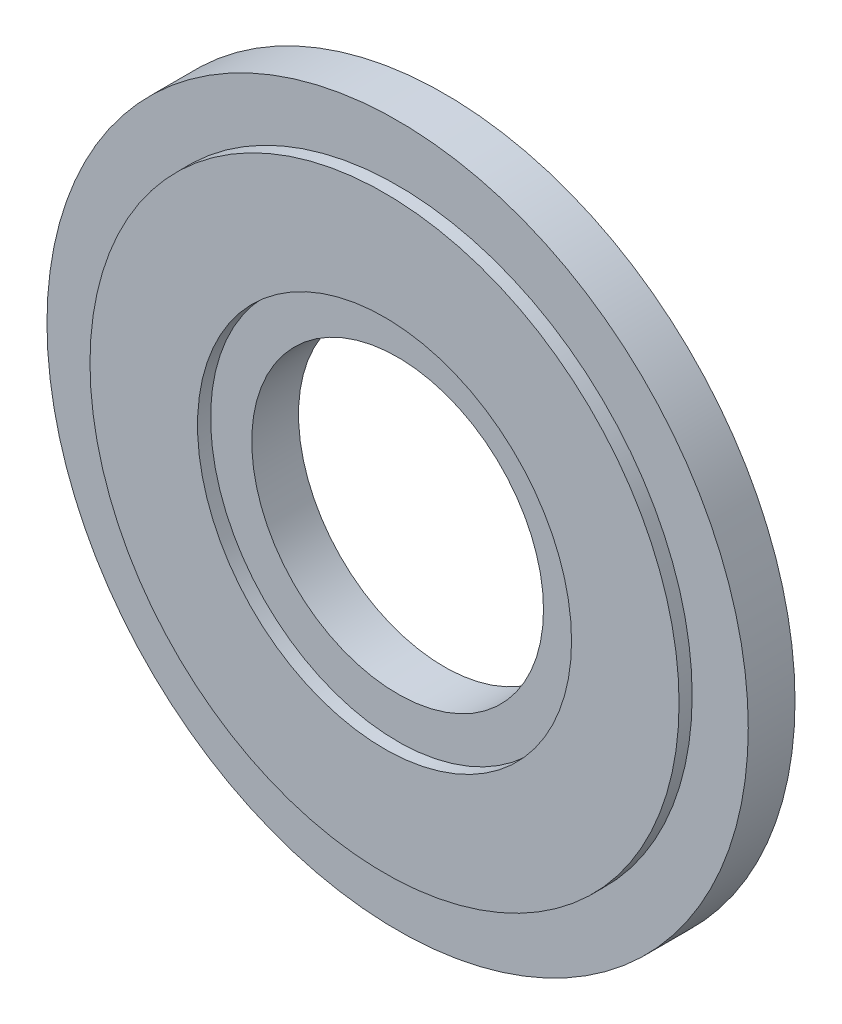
SolidWorks part; units mm, degrees
ref_plane "Plane1" through (0, 0, 0) normal (0, 0, 1) x (1, 0, 0)
ref_plane "Plane2" through (0, 0, 0) normal (0, 1, 0) x (1, 0, 0)
ref_plane "Plane3" through (0, 0, 0) normal (1, 0, 0) x (0, 0, -1)
sketch "Sketch1" plane through (0, 0, 0) normal (0, 0, 1) x (1, 0, 0)
  circle A0 centre (0, 0) radius 3.9624
  circle A1 centre (0, 0) radius 9.525
  dimension "D1" = 7.9248
  dimension "D2" = 19.05
extrude "Base-Extrude" add sketch "Sketch1" against normal blind 1.27
sketch "Sketch2" plane through (0, 0, 0) normal (0, 0, 1) x (1, 0, 0)
  circle A0 centre (0, 0) radius 5.08
  circle A1 centre (0, 0) radius 8.001
  dimension "D1" = 10.16
  dimension "D2" = 16.002
extrude "needle_footprint" add sketch "Sketch2" along normal blind 0.3556 and the other way blind 1.6256
